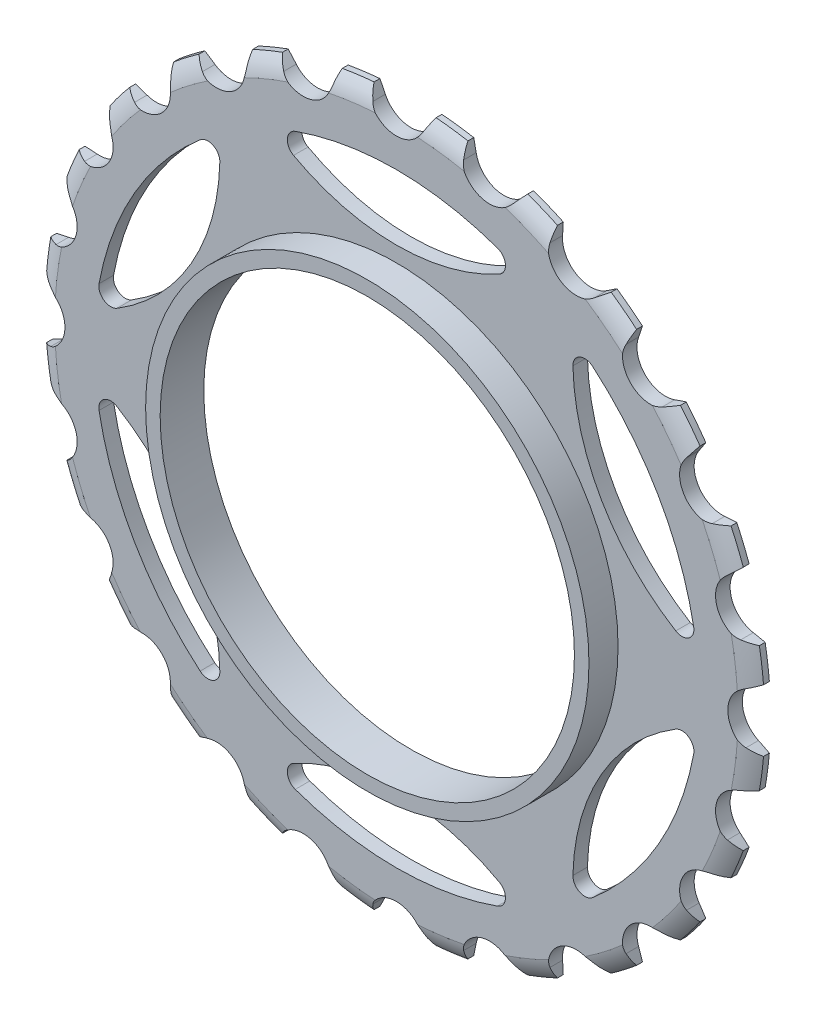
SolidWorks part; units mm, degrees
ref_plane "Front" through (0, 0, 0) normal (0, 0, 1) x (1, 0, 0)
ref_plane "Top" through (0, 0, 0) normal (0, 1, 0) x (1, 0, 0)
ref_plane "Right" through (0, 0, 0) normal (1, 0, 0) x (0, 0, -1)
sketch "Sketch1" plane through (0, 0, 0) normal (0, 0, 1) x (1, 0, 0)
  line L0 (0, 45.6) -> (0, 0) construction
  line L1 (0, 45.6) -> (0, 49.5) construction
  line L2 (0, 49.5) -> (0, 52.35) construction
  circle A0 centre (0, 0) radius 45.6 construction
  circle A3 centre (0, 0) radius 49.5 construction
  arc A4 (-5.7825, 52.0297) -> (-3.5183, 47.8173) centre (-49.3467, 25.8993) cw
  arc A5 (5.7825, 52.0297) -> (3.5183, 47.8173) centre (49.3467, 25.8993) ccw
  arc A6 (-3.5183, 47.8173) -> (3.5183, 47.8173) centre (0, 49.5) ccw
  arc A10 (5.7825, 52.0297) -> (-5.7825, 52.0297) centre (0, 0) ccw
  point P4 (6.3369, 49.0927)
  dimension "D1" = 2.85
  dimension "D2" = 3.9
  dimension "D3" = 50.8
  dimension "D5" = 11.5649
  dimension "D6" = 99
  dimension "D4" = 6.35
sketch "Sketch2" plane through (0, 0, 0) normal (1, 0, 0) x (0, 0, -1)
  line L0 (-1.2, 28.5) -> (0.8, 28.5)
  line L1 (0, 49.5) -> (0, -49.5) construction
  line L5 (-1.2, 28.5) -> (-1.2, 47)
  line L7 (0, 49.5) -> (0.8, 49.5)
  line L8 (0.8, 28.5) -> (0.8, 49.5)
  arc A0 (-1.2, 47) -> (0, 49.5) centre (4.1982, 45.9469) cw
  dimension "D4" = 2
  dimension "D7" = 5.5
  dimension "D1" = 28.5
  dimension "D5" = 2.5
  dimension "D6" = 0.8
ref_axis "Axis1" through (0, 0, -80.9) along (0, 0, 1)
revolve "Revolve1" add sketch "Sketch2" angle 360 about axis through (0, 0, -80.9) along (0, 0, 1)
extrude "Extrude1" cut sketch "Sketch1" against normal through all and the other way through all
sketch "Sketch3" plane through (0, 0, 0) normal (0, 0, 1) x (1, 0, 0)
  line L0 (0, 41.6) -> (0, 32.6) construction
  line L1 (-15, 37.787) -> (15, 37.787) construction
  line L2 (0, 45.6) -> (0, 41.6) construction
  arc A0 (-14.1501, 36.2145) -> (14.1501, 36.2145) centre (0, 62.1048) ccw
  arc A1 (-13.9115, 39.205) -> (13.9115, 39.205) centre (0, 0) cw
  arc A2 (-14.1501, 36.2145) -> (-13.9115, 39.205) centre (-13.362, 37.6564) cw
  arc A3 (13.9115, 39.205) -> (14.1501, 36.2145) centre (13.362, 37.6564) cw
  arc A4 (-2.9154, 46.9095) -> (2.9154, 46.9095) centre (0, 49.5) ccw construction
  arc A5 (0, 45.6) -> (-12.7065, 43.7939) centre (0, 0) ccw construction
  dimension "D1" = 9
  dimension "D2" = 4
  dimension "D3" = 3
  dimension "D4" = 30
extrude "Extrude2" cut sketch "Sketch3" against normal through all and the other way through all
pattern_circular "CirPattern1" count 24 over 360 about axis through (0, 0, 0) along (0, 0, 1) of "Extrude1"
pattern_circular "CirPattern2" count 6 over 360 about axis through (0, 0, 0) along (0, 0, 1) of "Extrude2"
sketch "Sketch4" plane through (0, 0, 1.2) normal (0, 0, 1) x (1, 0, 0)
  circle A0 centre (0, 0) radius 28.5 construction
  circle A1 centre (0, 0) radius 28.5
extrude "Extrude-Thin1" add sketch "Sketch4" along normal blind 4 thin
